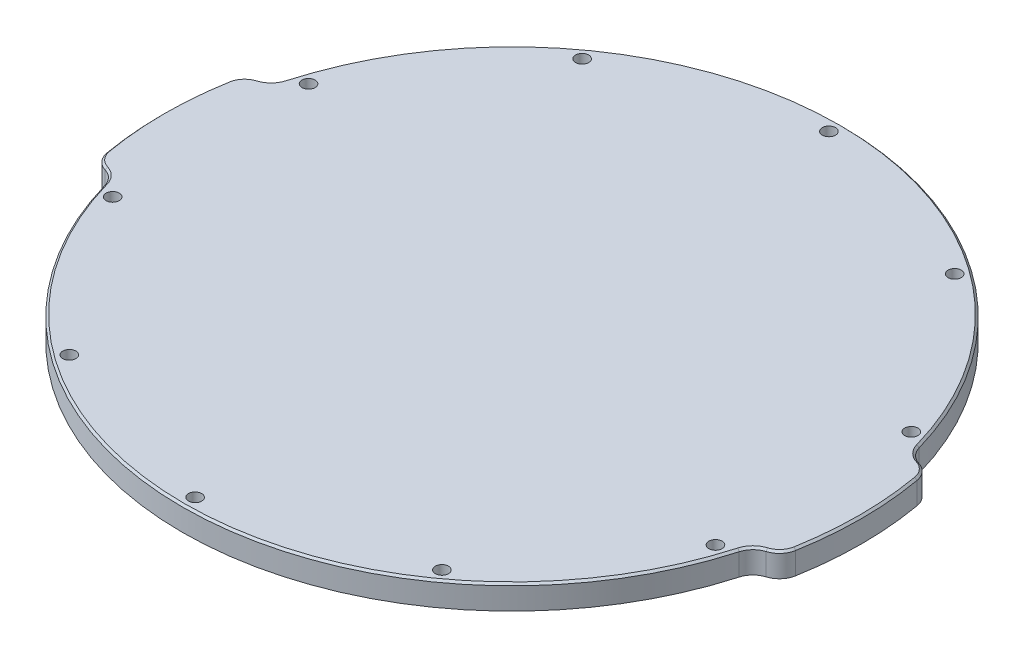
SolidWorks part; units mm, degrees
other "<WTE6-M-END-CAP-R1>-<Chamfer1>"
ref_plane "Front Plane" through (0, 0, 0) normal (0, 0, 1) x (1, 0, 0)
ref_plane "Top Plane" through (0, 0, 0) normal (0, 1, 0) x (1, 0, 0)
ref_plane "Right Plane" through (0, 0, 0) normal (1, 0, 0) x (0, 0, -1)
inserted part "WTE6-M-END-CAP-R1"
